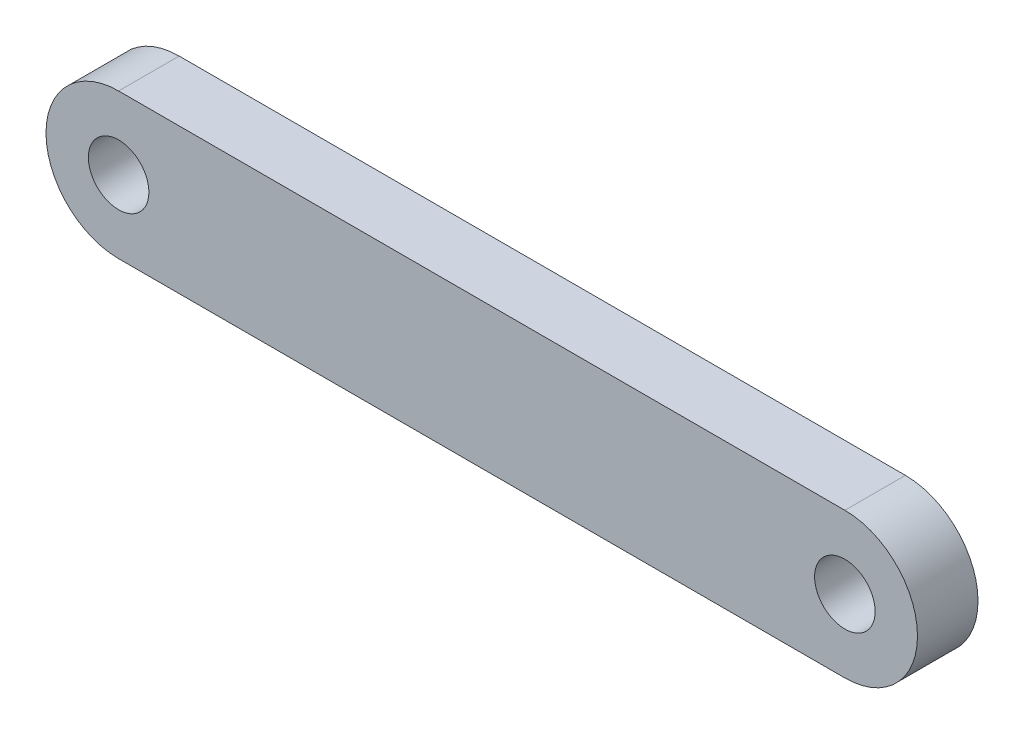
SolidWorks part; units mm, degrees
ref_plane "Alzado" through (0, 0, 0) normal (0, 0, 1) x (1, 0, 0)
ref_plane "Planta" through (0, 0, 0) normal (0, 1, 0) x (1, 0, 0)
ref_plane "Vista lateral" through (0, 0, 0) normal (1, 0, 0) x (0, 0, -1)
sketch "Croquis1" plane through (0, 0, 0) normal (0, 0, 1) x (1, 0, 0)
  line L0 (-30, 0) -> (30, 0) construction
  line L1 (-30, 6) -> (30, 6)
  line L2 (-30, -6) -> (30, -6)
  arc A0 (-30, 6) -> (-30, -6) centre (-30, 0) ccw
  arc A1 (30, -6) -> (30, 6) centre (30, 0) ccw
  circle A2 centre (30, 0) radius 2.5
  circle A3 centre (-30, 0) radius 2.5
  point P3 (0, 0)
  dimension "D2" = 6
  dimension "D3" = 5
  dimension "D4" = 5
  dimension "D1" = 60
extrude "Saliente-Extruir1" add sketch "Croquis1" along normal mid plane 5
